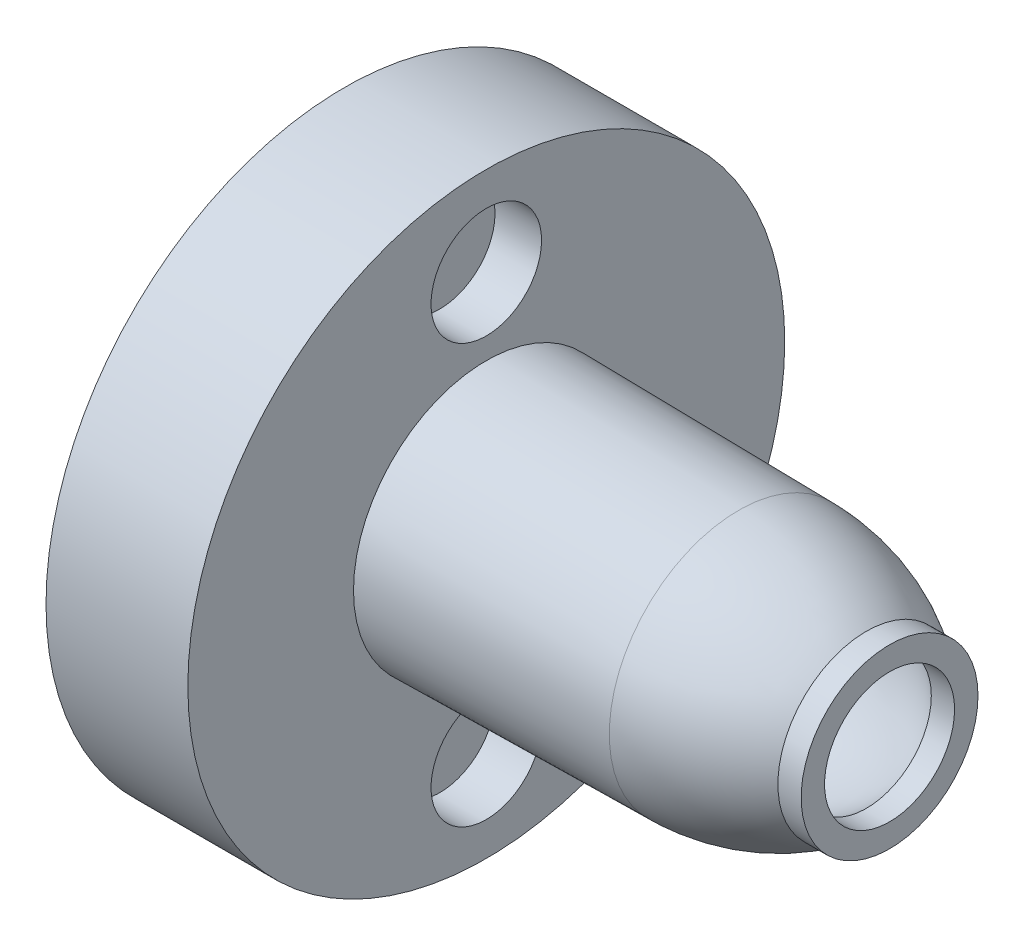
SolidWorks part; units mm, degrees
ref_plane "Front Plane" through (0, 0, 0) normal (0, 0, 1) x (1, 0, 0)
ref_plane "Top Plane" through (0, 0, 0) normal (0, 1, 0) x (1, 0, 0)
ref_plane "Right Plane" through (0, 0, 0) normal (1, 0, 0) x (0, 0, -1)
sketch "Sketch1" plane through (0, 0, 0) normal (0, 1, 0) x (1, 0, 0)
  line L0 (-1, 2.3995) -> (0, 2.3995)
  line L1 (0, 2.3995) -> (0, 1.3931)
  line L2 (0, 1.3931) -> (-1, 1.3931)
  line L3 (-6.4864, 4.1592) -> (-6.4864, 3.2326)
  line L4 (0, -1.4009) -> (-7.7416, -1.4009) construction
  arc A0 (-1, 2.3995) -> (-6.4864, 4.1592) centre (-6.5058, -5.334) ccw
  arc A1 (-1, 1.3931) -> (-6.4864, 3.2326) centre (-6.6446, -6.3408) ccw
  dimension "D1" = 2.794
revolve "Revolve1" add sketch "Sketch1" angle 360 about L4
sketch "Sketch2" plane through (0, 0, 0) normal (0, 1, 0) x (1, 0, 0)
  line L0 (8.3218, -1.4009) -> (-17.1874, -1.4009) construction
  line L1 (-6.4864, 4.1592) -> (-17.3322, 4.3069)
  line L2 (-23.4282, 3.4633) -> (-6.4864, 3.2326) construction
  line L4 (-23.4282, 4.2614) -> (-23.4282, 3.5903)
  line L5 (-6.4864, 3.3596) -> (-6.4864, 4.1592)
  line L15 (-17.3322, 7.1081) -> (-17.3322, 11.4261)
  line L16 (-17.3322, 11.4261) -> (-23.4282, 11.4261)
  line L17 (-23.4282, 11.4261) -> (-23.4282, 4.2614)
  line L18 (-17.3322, 7.1081) -> (-17.3322, 4.3069)
  line L19 (-6.4864, 3.3596) -> (-23.4282, 3.5903)
  line L20 (-23.4282, 3.5903) -> (-23.4282, 3.4633) construction
  point P6 (0, 0)
  point P8 (0, 0)
  point P9 (0, 0)
  point P12 (0, 0)
  point P17 (0, 0)
  point P18 (0, 0)
  point P19 (0, 0)
  point P20 (0, 0)
  point P22 (0, 0)
  point P23 (0, 0)
  point P32 (0, 0)
  point P33 (0, 0)
  point P34 (0, 0)
  point P35 (0, 0)
  point P36 (0, 0)
  point P37 (0, 0)
  point P38 (0, 0)
  point P39 (0, 0)
  point P40 (0, 0)
  point P41 (0, 0)
  point P42 (0, 0)
  point P43 (0, 0)
  point P44 (0, 0)
  point P45 (0, 0)
  point P46 (0, 0)
  point P47 (0, 0)
  point P48 (0, 0)
revolve "Revolve2" add sketch "Sketch2" angle 360 about L0
sketch "Sketch3" plane through (-23.4282, 0, 0) normal (-1, 0, 0) x (0, 0, 1)
  line L0 (1.4009, 0) -> (1.4009, 8.7564)
ref_plane "MidPlane" through (0, 0, 1.4009) normal (0, 0, 1) x (1, 0, 0)
sketch "Sketch4" plane through (-23.4282, 0, 0) normal (-1, 0, 0) x (0, 0, 1)
  line L0 (1.4009, 0) -> (12.0116, 0)
sketch "Sketch5" plane through (-17.3322, 0, 0) normal (1, 0, 0) x (0, 0, -1)
  circle A0 centre (-1.4009, -9) radius 2.375
  circle A1 centre (-1.4009, 9) radius 2.375
  dimension "D1" = 4.75
extrude "Cut-Extrude1" cut sketch "Sketch5" against normal blind 2
